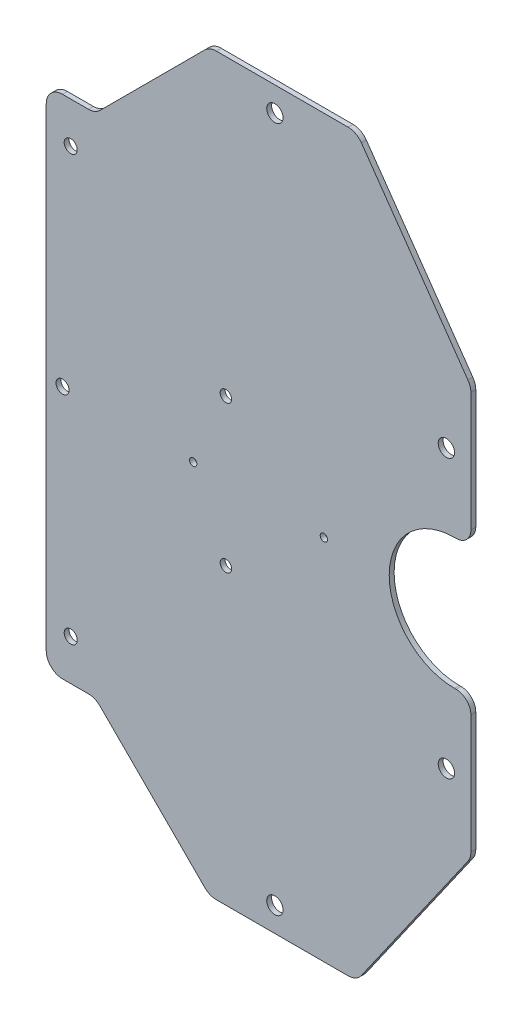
SolidWorks part; units mm, degrees
ref_plane "Plan1" through (0, 0, 0) normal (0, 0, 1) x (1, 0, 0)
ref_plane "Plan2" through (0, 0, 0) normal (0, 1, 0) x (1, 0, 0)
ref_plane "Plan3" through (0, 0, 0) normal (1, 0, 0) x (0, 0, -1)
sketch "Esquisse1" plane through (0, 0, 0) normal (0, 0, 1) x (1, 0, 0)
  line L0 (-149.9289, 222.0711) -> (-214.0711, 157.9289)
  line L1 (-142.8579, 225) -> (-62.2066, 225)
  line L2 (-247, 125) -> (-247, -125)
  line L3 (-142.8579, -225) -> (-62.2066, -225)
  line L4 (13, 121.8478) -> (13, 49)
  line L5 (-214.0711, -157.9289) -> (-149.9289, -222.0711)
  line L6 (11.1923, -127.5824) -> (-54.0142, -220.7346)
  line L7 (-54.0142, 220.7346) -> (11.1923, 127.5824)
  line L8 (-221.1421, -155) -> (-237, -155)
  line L9 (-247, -145) -> (-247, -125)
  line L12 (-221.1421, 155) -> (-237, 155)
  line L13 (-247, 145) -> (-247, 125)
  line L14 (3, 40) -> (4, 40)
  line L15 (3, -40) -> (4, -40)
  line L16 (13, -49) -> (13, -121.8478)
  arc A0 (-54.0142, 220.7346) -> (-62.2066, 225) centre (-62.2066, 215) ccw
  arc A1 (13, 121.8478) -> (11.1923, 127.5824) centre (3, 121.8478) ccw
  circle A2 centre (-232, 130) radius 4
  circle A3 centre (-2, -85) radius 5
  circle A4 centre (-107, 210) radius 5
  circle A5 centre (-232, -130) radius 4
  arc A6 (11.1923, -127.5824) -> (13, -121.8478) centre (3, -121.8478) ccw
  arc A7 (-62.2066, -225) -> (-54.0142, -220.7346) centre (-62.2066, -215) ccw
  circle A8 centre (-237, 0) radius 4
  circle A9 centre (-2, 85) radius 5
  circle A10 centre (-107, -210) radius 5
  circle A12 centre (-137, 45) radius 3.5
  circle A13 centre (-137, -45) radius 3.5
  arc A14 (-247, -145) -> (-237, -155) centre (-237, -145) ccw
  arc A15 (-214.0711, -157.9289) -> (-221.1421, -155) centre (-221.1421, -165) ccw
  arc A16 (-142.8579, -225) -> (-149.9289, -222.0711) centre (-142.8579, -215) cw
  arc A18 (-142.8579, 225) -> (-149.9289, 222.0711) centre (-142.8579, 215) ccw
  arc A20 (-221.1421, 155) -> (-214.0711, 157.9289) centre (-221.1421, 165) ccw
  arc A21 (-247, 145) -> (-237, 155) centre (-237, 145) cw
  arc A22 (3, 40) -> (3, -40) centre (3, 0) ccw
  arc A23 (13, 49) -> (4, 40) centre (4, 49) cw
  arc A24 (13, -49) -> (4, -40) centre (4, -49) ccw
  circle A26 centre (-157, 0) radius 2.25
  circle A27 centre (-77, 0) radius 2.25
  point P2 (-57, 225)
  point P8 (13, 225)
  point P11 (13, -225)
  point P20 (13, 125)
  point P28 (13, -125)
  point P42 (-247, -155)
  point P45 (-217, -155)
  point P46 (-147, -225)
  point P47 (-57, -225)
  point P56 (-147, 225)
  point P64 (-217, 155)
  point P67 (-247, 155)
  point P77 (13, -40)
  dimension "D3" = 100
  dimension "D4" = 100
  dimension "D15" = 15
  dimension "D28" = 10
  dimension "D30" = 40
  dimension "D7" = 10
  dimension "D8" = 10
  dimension "D9" = 8
  dimension "D26" = 10
  dimension "D29" = 85
  dimension "D31" = 9
  dimension "D23" = 10
  dimension "D13" = 15
  dimension "D44" = 80
  dimension "D45" = 90
  dimension "D46" = 4.5
  dimension "D10" = 260
  dimension "D17" = 170
  dimension "D14" = 130
  dimension "D36" = 120
  dimension "D42" = 15
  dimension "D47" = 420
  dimension "D1" = 260
  dimension "D2" = 450
  dimension "D5" = 100
  dimension "D6" = 100
  dimension "D11" = 310
  dimension "D12" = 155
  dimension "D16" = 85
  dimension "D20" = 90
  dimension "D22" = 110
  dimension "D25" = 30
  dimension "D27" = 30
  dimension "D32" = 10
  dimension "D35" = 10
  dimension "D38" = 100
  dimension "D39" = 70
  dimension "D40" = 100
  dimension "D41" = 15
  dimension "D43" = 45
extrude "Base-Extrusion" add sketch "Esquisse1" along normal blind 3
